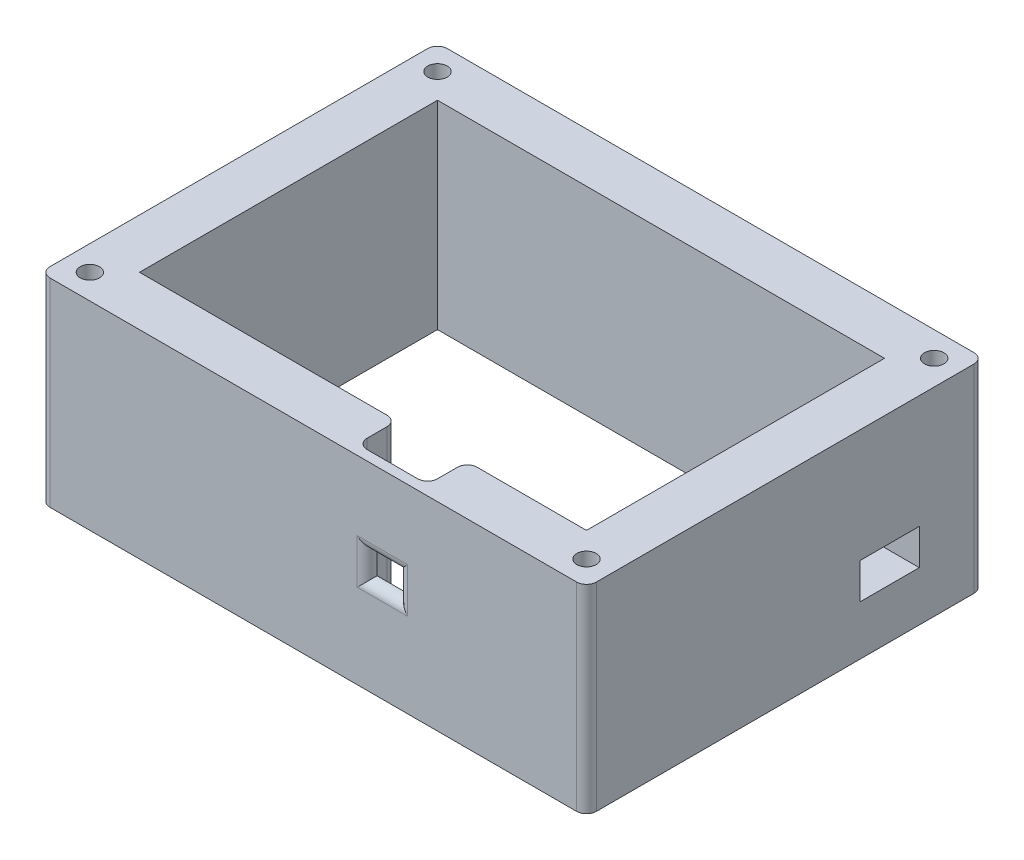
SolidWorks part; units mm, degrees
ref_plane "Front Plane" through (0, 0, 0) normal (0, 0, 1) x (1, 0, 0)
ref_plane "Top Plane" through (0, 0, 0) normal (0, 1, 0) x (1, 0, 0)
ref_plane "Right Plane" through (0, 0, 0) normal (1, 0, 0) x (0, 0, -1)
sketch "Sketch1" plane through (0, 0, 0) normal (0, 1, 0) x (1, 0, 0)
  line L0 (0, 50.8) -> (0, 38.1) construction
  line L1 (-69.85, -50.8) -> (69.85, -50.8)
  line L2 (-69.85, -50.8) -> (-69.85, 50.8)
  line L3 (-69.85, 50.8) -> (69.85, 50.8)
  line L4 (69.85, -50.8) -> (69.85, 50.8)
  line L5 (-69.85, -50.8) -> (69.85, 50.8) construction
  line L6 (-69.85, 50.8) -> (69.85, -50.8) construction
  line L7 (-57.15, -38.1) -> (57.15, -38.1)
  line L8 (-57.15, -38.1) -> (-57.15, 38.1)
  line L9 (-57.15, 38.1) -> (57.15, 38.1)
  line L10 (57.15, -38.1) -> (57.15, 38.1)
  line L11 (-57.15, -38.1) -> (57.15, 38.1) construction
  line L12 (-57.15, 38.1) -> (57.15, -38.1) construction
  line L13 (57.15, 0) -> (69.85, 0) construction
  line L15 (69.85, 50.8) -> (63.5, 50.8) construction
  line L16 (69.85, 50.8) -> (69.85, 44.45) construction
  line L17 (69.85, 44.45) -> (63.5, 44.45) construction
  line L18 (63.5, 50.8) -> (63.5, 44.45) construction
  line L19 (69.85, -50.8) -> (63.5, -50.8) construction
  line L20 (69.85, -50.8) -> (69.85, -44.45) construction
  line L21 (69.85, -44.45) -> (63.5, -44.45) construction
  line L22 (63.5, -50.8) -> (63.5, -44.45) construction
  line L23 (-69.85, 50.8) -> (-63.5, 50.8) construction
  line L24 (-69.85, 50.8) -> (-69.85, 44.45) construction
  line L25 (-69.85, 44.45) -> (-63.5, 44.45) construction
  line L26 (-63.5, 50.8) -> (-63.5, 44.45) construction
  circle A0 centre (63.5, 44.45) radius 2.4765
  circle A1 centre (-63.5, 44.45) radius 2.4765
  circle A2 centre (-63.5, -44.45) radius 2.4765
  circle A3 centre (63.5, -44.45) radius 2.4765
  circle A4 centre (63.5, 44.45) radius 5.2832 construction
  point P0 (0, 0)
  point P6 (0, 0)
  dimension "D1" = 4.953
  dimension "D6" = 10.5664
  dimension "D2" = 6.35
  dimension "D3" = 12.7
  dimension "D4" = 114.3
  dimension "D5" = 76.2
extrude "Boss-Extrude1" add sketch "Sketch1" along normal blind 50.8
sketch "Sketch3" plane through (0, 0, 0) normal (0, 1, 0) x (1, 0, 0)
  circle A0 centre (-63.5, 44.45) radius 5.6515
  circle A1 centre (63.5, 44.45) radius 5.6515
  circle A2 centre (63.5, -44.45) radius 5.6515
  circle A3 centre (-63.5, -44.45) radius 5.6515
  dimension "D1" = 11.303
extrude "Cut-Extrude1" cut sketch "Sketch3" along normal blind 20.32
sketch "Sketch4" plane through (0, 20.32, 0) normal (0, -1, 0) x (1, 0, 0)
  circle A0 centre (-63.5, -44.45) radius 2.9845
  circle A1 centre (63.5, -44.45) radius 2.9845
  circle A2 centre (63.5, 44.45) radius 2.9845
  circle A3 centre (-63.5, 44.45) radius 2.9845
  dimension "D1" = 5.969
extrude "Cut-Extrude2" cut sketch "Sketch4" against normal blind 9.906
sketch "Sketch5" plane through (0, 0, 0) normal (0, -1, 0) x (1, 0, 0)
  line L0 (-57.15, 38.1) -> (57.15, 38.1) construction
  line L1 (8.6852, 38.1) -> (26.67, 38.1)
  line L2 (8.6852, 38.1) -> (8.6852, 48.26)
  line L3 (8.6852, 48.26) -> (26.67, 48.26)
  line L4 (26.67, 38.1) -> (26.67, 48.26)
  line L5 (57.15, 38.1) -> (57.15, -38.1) construction
  line L6 (-69.85, 50.8) -> (69.85, 50.8) construction
  dimension "D1" = 30.48
  dimension "D2" = 17.9848
  dimension "D3" = 2.54
extrude "Cut-Extrude3" cut sketch "Sketch5" against normal through all both and the other way through all
fillet "Fillet1" radius 2.54 4 edges at (26.67, 25.4, 38.1) (8.6852, 25.4, 38.1) (8.6852, 25.4, 48.26) (26.67, 25.4, 48.26)
ref_plane "Plane1" through (17.6776, 0, 0) normal (-1, 0, 0) x (0, 0, 1)
sketch "Sketch6" plane through (0, 0, 48.26) normal (0, 0, -1) x (-1, 0, 0)
  line L1 (-21.59, 24.13) -> (-13.7652, 24.13)
  line L2 (-21.59, 24.13) -> (-21.59, 30.48)
  line L3 (-21.59, 30.48) -> (-13.7652, 30.48)
  line L4 (-13.7652, 24.13) -> (-13.7652, 30.48)
  line L5 (-21.59, 24.13) -> (-13.7652, 30.48) construction
  line L6 (-21.59, 30.48) -> (-13.7652, 24.13) construction
  line L8 (-24.13, 50.8) -> (-11.2252, 50.8) construction
  line L9 (-24.13, 0) -> (-11.2252, 0) construction
  line L10 (-24.13, 50.8) -> (-24.13, 0) construction
  line L11 (-11.2252, 0) -> (-11.2252, 50.8) construction
  point P0 (-17.6776, 27.305)
  dimension "D1" = 20.32
  dimension "D2" = 24.13
  dimension "D3" = 2.54
  dimension "D4" = 2.54
extrude "Cut-Extrude4" cut sketch "Sketch6" against normal through all both
fillet "Fillet2" radius 2.54 4 edges at (17.6776, 24.13, 50.8) (21.59, 27.305, 50.8) (13.7652, 27.305, 50.8) (17.6776, 30.48, 50.8)
fillet "Fillet3" radius 2.54 4 edges at (-69.85, 25.4, -50.8) (-69.85, 25.4, 50.8) (69.85, 25.4, 50.8) (69.85, 25.4, -50.8)
sketch "Sketch7" plane through (69.85, 0, 0) normal (1, 0, 0) x (0, 0, -1)
  line L1 (19.1262, 12.7) -> (34.29, 12.7)
  line L2 (19.1262, 12.7) -> (19.1262, 21.844)
  line L3 (19.1262, 21.844) -> (34.29, 21.844)
  line L4 (34.29, 12.7) -> (34.29, 21.844)
  line L5 (19.1262, 12.7) -> (34.29, 21.844) construction
  line L6 (19.1262, 21.844) -> (34.29, 12.7) construction
  line L7 (-48.26, 0) -> (48.26, 0) construction
  line L8 (50.8, 50.8) -> (50.8, 0) construction
  point P0 (26.7081, 17.272)
  dimension "D1" = 12.7
  dimension "D2" = 16.51
  dimension "D3" = 15.1638
  dimension "D4" = 9.144
extrude "Cut-Extrude5" cut sketch "Sketch7" against normal blind 17.78
fillet "Fillet4" radius 2.54 4 edges at (57.15, 17.272, -19.1262) (57.15, 12.7, -26.7081) (57.15, 17.272, -34.29) (57.15, 21.844, -26.7081)
